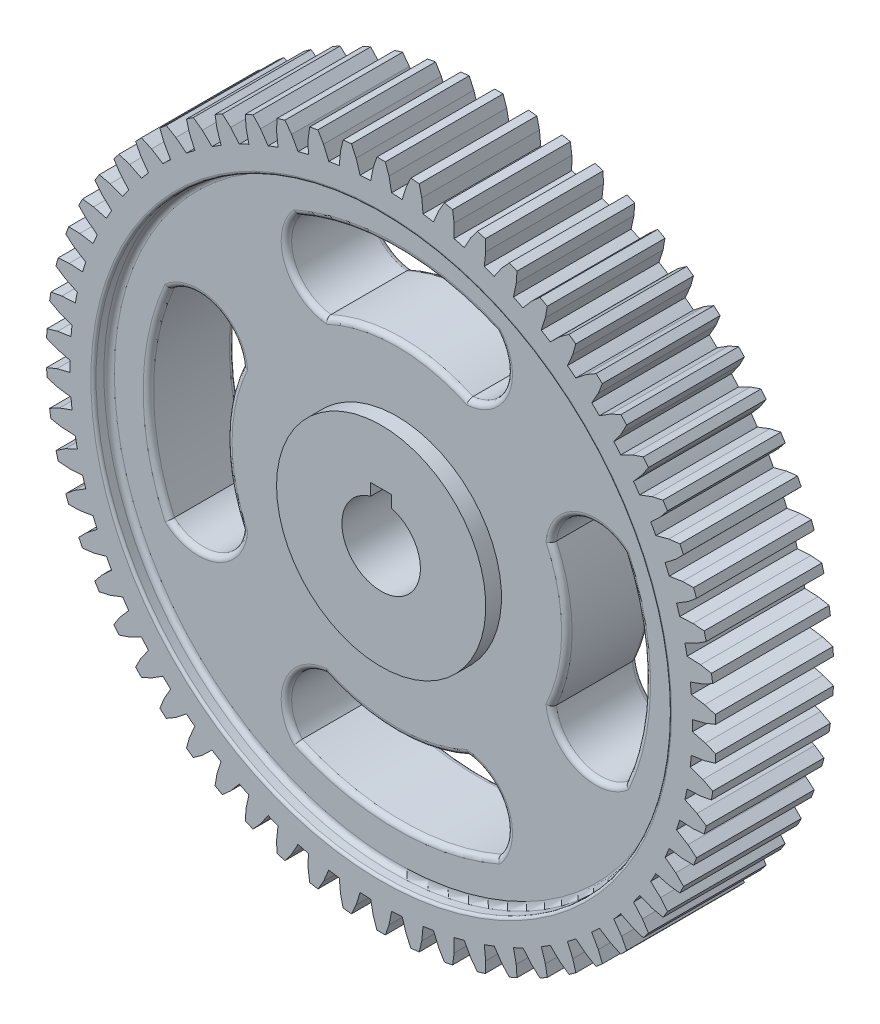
SolidWorks part; units mm, degrees
ref_plane "Front Plane" through (0, 0, 0) normal (0, 0, 1) x (1, 0, 0)
ref_plane "Top Plane" through (0, 0, 0) normal (0, 1, 0) x (1, 0, 0)
ref_plane "Right Plane" through (0, 0, 0) normal (1, 0, 0) x (0, 0, -1)
sketch "Sketch1" plane through (0, 0, 0) normal (0, 0, 1) x (1, 0, 0)
  line L0 (0, 151.13) -> (0, 197.7201) construction
  line L1 (-5.08, 151.0446) -> (-3.81, 157.4339)
  line L2 (-3.81, 157.4339) -> (-2.032, 162.5473)
  line L3 (5.08, 151.0446) -> (3.81, 157.4339)
  line L4 (3.81, 157.4339) -> (2.032, 162.5473)
  line L5 (-2.032, 162.5473) -> (2.032, 162.5473)
  line L6 (14.4231, 161.9189) -> (18.4662, 161.5077)
  line L7 (12.1369, 157.0116) -> (14.4231, 161.9189)
  line L8 (19.7178, 156.2407) -> (18.4662, 161.5077)
  line L9 (10.227, 150.7836) -> (12.1369, 157.0116)
  line L10 (20.3349, 149.7557) -> (19.7178, 156.2407)
  line L11 (30.7301, 159.629) -> (34.7109, 158.8109)
  line L12 (27.9592, 154.9782) -> (30.7301, 159.629)
  line L13 (35.4232, 153.4443) -> (34.7109, 158.8109)
  line L14 (25.429, 148.9753) -> (27.9592, 154.9782)
  line L15 (35.3811, 146.9301) -> (35.4232, 153.4443)
  line L16 (46.7219, 155.7011) -> (50.5995, 154.4845)
  line L17 (43.4946, 151.3544) -> (46.7219, 155.7011)
  line L18 (50.7652, 149.0733) -> (50.5995, 154.4845)
  line L19 (40.3702, 145.6383) -> (43.4946, 151.3544)
  line L20 (50.0642, 142.5968) -> (50.7652, 149.0733)
  line L21 (62.2342, 150.1754) -> (65.9688, 148.5728)
  line L22 (58.5838, 146.1776) -> (62.2342, 150.1754)
  line L23 (65.5862, 143.1726) -> (65.9688, 148.5728)
  line L24 (54.897, 140.8069) -> (58.5838, 146.1776)
  line L25 (64.2336, 136.8003) -> (65.5862, 143.1726)
  line L26 (77.1079, 143.1088) -> (80.6612, 141.1365)
  line L27 (73.0717, 139.5008) -> (77.1079, 143.1088)
  line L28 (79.7342, 135.8028) -> (80.6612, 141.1365)
  line L29 (68.8606, 134.5307) -> (73.0717, 139.5008)
  line L30 (77.7439, 129.6) -> (79.7342, 135.8028)
  line L31 (91.1903, 134.5737) -> (94.5259, 132.2521)
  line L32 (86.8099, 131.3925) -> (91.1903, 134.5737)
  line L33 (93.0641, 127.0395) -> (94.5259, 132.2521)
  line L34 (82.1175, 126.8739) -> (86.8099, 131.3925)
  line L35 (90.4565, 121.0698) -> (93.0641, 127.0395)
  line L36 (104.337, 124.6577) -> (107.4206, 122.0105)
  line L37 (99.6572, 121.936) -> (104.337, 124.6577)
  line L38 (105.439, 116.9725) -> (107.4206, 122.0105)
  line L39 (94.5318, 117.9153) -> (99.6572, 121.936)
  line L40 (102.2408, 111.2973) -> (105.439, 116.9725)
  line L41 (116.4131, 113.4625) -> (119.2131, 110.5169)
  line L42 (111.482, 111.2282) -> (116.4131, 113.4625)
  line L43 (116.7319, 105.7053) -> (119.2131, 110.5169)
  line L44 (105.9761, 107.7467) -> (111.482, 111.2282)
  line L45 (112.976, 100.3828) -> (116.7319, 105.7053)
  line L46 (127.2947, 101.103) -> (129.7823, 97.8893)
  line L47 (122.1628, 99.3791) -> (127.2947, 101.103)
  line L48 (126.827, 93.3534) -> (129.7823, 97.8893)
  line L49 (116.3329, 96.4724) -> (122.1628, 99.3791)
  line L50 (122.5519, 88.4382) -> (126.827, 93.3534)
  line L51 (136.87, 87.7061) -> (139.0197, 84.2572)
  line L52 (131.59, 86.5102) -> (136.87, 87.7061)
  line L53 (135.6207, 80.0435) -> (139.0197, 84.2572)
  line L54 (125.496, 84.2083) -> (131.59, 86.5102)
  line L55 (130.8703, 75.586) -> (135.6207, 80.0435)
  line L56 (145.0408, 73.4092) -> (146.8306, 69.7605)
  line L57 (139.667, 72.7536) -> (145.0408, 73.4092)
  line L58 (143.0228, 65.9123) -> (146.8306, 69.7605)
  line L59 (133.3713, 71.08) -> (139.667, 72.7536)
  line L60 (137.8457, 61.9583) -> (143.0228, 65.9123)
  line L61 (151.7234, 58.359) -> (153.1348, 54.548)
  line L62 (146.3107, 58.2505) -> (151.7234, 58.359)
  line L63 (148.9572, 51.1048) -> (153.1348, 54.548)
  line L64 (139.8781, 57.2224) -> (146.3107, 58.2505)
  line L65 (143.4067, 47.6948) -> (148.9572, 51.1048)
  line L66 (156.849, 42.71) -> (157.8676, 38.7758)
  line L67 (151.4532, 43.1496) -> (156.849, 42.71)
  line L68 (153.3631, 35.7728) -> (157.8676, 38.7758)
  line L69 (144.9495, 42.7775) -> (151.4532, 43.1496)
  line L70 (147.4961, 32.9419) -> (153.3631, 35.7728)
  line L71 (160.3652, 26.6227) -> (160.9806, 22.6056)
  line L72 (155.0415, 27.6059) -> (160.3652, 26.6227)
  line L73 (156.1954, 20.0738) -> (160.9806, 22.6056)
  line L74 (148.5335, 27.8938) -> (155.0415, 27.6059)
  line L75 (150.0721, 17.8509) -> (156.1954, 20.0738)
  line L76 (162.2358, 10.2623) -> (162.4416, 6.2035)
  line L77 (157.0389, 11.779) -> (162.2358, 10.2623)
  line L78 (157.4248, 4.1688) -> (162.4416, 6.2035)
  line L79 (150.5934, 12.7238) -> (157.0389, 11.779)
  line L80 (151.108, 2.5768) -> (157.4248, 4.1688)
  line L81 (162.4416, -6.2035) -> (162.2358, -10.2623)
  line L82 (157.4248, -4.1688) -> (162.4416, -6.2035)
  line L83 (157.0389, -11.779) -> (162.2358, -10.2623)
  line L84 (151.108, -2.5768) -> (157.4248, -4.1688)
  line L85 (150.5934, -12.7238) -> (157.0389, -11.779)
  line L86 (160.9806, -22.6056) -> (160.3652, -26.6227)
  line L87 (156.1954, -20.0738) -> (160.9806, -22.6056)
  line L88 (155.0415, -27.6059) -> (160.3652, -26.6227)
  line L89 (150.0721, -17.8509) -> (156.1954, -20.0738)
  line L90 (148.5335, -27.8938) -> (155.0415, -27.6059)
  line L91 (157.8676, -38.7758) -> (156.849, -42.71)
  line L92 (153.3631, -35.7728) -> (157.8676, -38.7758)
  line L93 (151.4532, -43.1496) -> (156.849, -42.71)
  line L94 (147.4961, -32.9419) -> (153.3631, -35.7728)
  line L95 (144.9495, -42.7775) -> (151.4532, -43.1496)
  line L96 (153.1348, -54.548) -> (151.7234, -58.359)
  line L97 (148.9572, -51.1048) -> (153.1348, -54.548)
  line L98 (146.3107, -58.2505) -> (151.7234, -58.359)
  line L99 (143.4067, -47.6948) -> (148.9572, -51.1048)
  line L100 (139.8781, -57.2224) -> (146.3107, -58.2505)
  line L101 (146.8306, -69.7605) -> (145.0408, -73.4092)
  line L102 (143.0228, -65.9123) -> (146.8306, -69.7605)
  line L103 (139.667, -72.7536) -> (145.0408, -73.4092)
  line L104 (137.8457, -61.9583) -> (143.0228, -65.9123)
  line L105 (133.3713, -71.08) -> (139.667, -72.7536)
  line L106 (139.0197, -84.2572) -> (136.87, -87.7061)
  line L107 (135.6207, -80.0435) -> (139.0197, -84.2572)
  line L108 (131.59, -86.5102) -> (136.87, -87.7061)
  line L109 (130.8703, -75.586) -> (135.6207, -80.0435)
  line L110 (125.496, -84.2083) -> (131.59, -86.5102)
  line L111 (129.7823, -97.8893) -> (127.2947, -101.103)
  line L112 (126.827, -93.3534) -> (129.7823, -97.8893)
  line L113 (122.1628, -99.3791) -> (127.2947, -101.103)
  line L114 (122.5519, -88.4382) -> (126.827, -93.3534)
  line L115 (116.3329, -96.4724) -> (122.1628, -99.3791)
  line L116 (119.2131, -110.5169) -> (116.4131, -113.4625)
  line L117 (116.7319, -105.7053) -> (119.2131, -110.5169)
  line L118 (111.482, -111.2282) -> (116.4131, -113.4625)
  line L119 (112.976, -100.3828) -> (116.7319, -105.7053)
  line L120 (105.9761, -107.7467) -> (111.482, -111.2282)
  line L121 (107.4206, -122.0105) -> (104.337, -124.6577)
  line L122 (105.439, -116.9725) -> (107.4206, -122.0105)
  line L123 (99.6572, -121.936) -> (104.337, -124.6577)
  line L124 (102.2408, -111.2973) -> (105.439, -116.9725)
  line L125 (94.5318, -117.9153) -> (99.6572, -121.936)
  line L126 (94.5259, -132.2521) -> (91.1903, -134.5737)
  line L127 (93.0641, -127.0395) -> (94.5259, -132.2521)
  line L128 (86.8099, -131.3925) -> (91.1903, -134.5737)
  line L129 (90.4565, -121.0698) -> (93.0641, -127.0395)
  line L130 (82.1175, -126.8739) -> (86.8099, -131.3925)
  line L131 (80.6612, -141.1365) -> (77.1079, -143.1088)
  line L132 (79.7342, -135.8028) -> (80.6612, -141.1365)
  line L133 (73.0717, -139.5008) -> (77.1079, -143.1088)
  line L134 (77.7439, -129.6) -> (79.7342, -135.8028)
  line L135 (68.8606, -134.5307) -> (73.0717, -139.5008)
  line L136 (65.9688, -148.5728) -> (62.2342, -150.1754)
  line L137 (65.5862, -143.1726) -> (65.9688, -148.5728)
  line L138 (58.5838, -146.1776) -> (62.2342, -150.1754)
  line L139 (64.2336, -136.8003) -> (65.5862, -143.1726)
  line L140 (54.897, -140.8069) -> (58.5838, -146.1776)
  line L141 (50.5995, -154.4845) -> (46.7219, -155.7011)
  line L142 (50.7652, -149.0733) -> (50.5995, -154.4845)
  line L143 (43.4946, -151.3544) -> (46.7219, -155.7011)
  line L144 (50.0642, -142.5968) -> (50.7652, -149.0733)
  line L145 (40.3702, -145.6383) -> (43.4946, -151.3544)
  line L146 (34.7109, -158.8109) -> (30.7301, -159.629)
  line L147 (35.4232, -153.4443) -> (34.7109, -158.8109)
  line L148 (27.9592, -154.9782) -> (30.7301, -159.629)
  line L149 (35.3811, -146.9301) -> (35.4232, -153.4443)
  line L150 (25.429, -148.9753) -> (27.9592, -154.9782)
  line L151 (18.4662, -161.5077) -> (14.4231, -161.9189)
  line L152 (19.7178, -156.2407) -> (18.4662, -161.5077)
  line L153 (12.1369, -157.0116) -> (14.4231, -161.9189)
  line L154 (20.3349, -149.7557) -> (19.7178, -156.2407)
  line L155 (10.227, -150.7836) -> (12.1369, -157.0116)
  line L156 (2.032, -162.5473) -> (-2.032, -162.5473)
  line L157 (3.81, -157.4339) -> (2.032, -162.5473)
  line L158 (-3.81, -157.4339) -> (-2.032, -162.5473)
  line L159 (5.08, -151.0446) -> (3.81, -157.4339)
  line L160 (-5.08, -151.0446) -> (-3.81, -157.4339)
  line L161 (-14.4231, -161.9189) -> (-18.4662, -161.5077)
  line L162 (-12.1369, -157.0116) -> (-14.4231, -161.9189)
  line L163 (-19.7178, -156.2407) -> (-18.4662, -161.5077)
  line L164 (-10.227, -150.7836) -> (-12.1369, -157.0116)
  line L165 (-20.3349, -149.7557) -> (-19.7178, -156.2407)
  line L166 (-30.7301, -159.629) -> (-34.7109, -158.8109)
  line L167 (-27.9592, -154.9782) -> (-30.7301, -159.629)
  line L168 (-35.4232, -153.4443) -> (-34.7109, -158.8109)
  line L169 (-25.429, -148.9753) -> (-27.9592, -154.9782)
  line L170 (-35.3811, -146.9301) -> (-35.4232, -153.4443)
  line L171 (-46.7219, -155.7011) -> (-50.5995, -154.4845)
  line L172 (-43.4946, -151.3544) -> (-46.7219, -155.7011)
  line L173 (-50.7652, -149.0733) -> (-50.5995, -154.4845)
  line L174 (-40.3702, -145.6383) -> (-43.4946, -151.3544)
  line L175 (-50.0642, -142.5968) -> (-50.7652, -149.0733)
  line L176 (-62.2342, -150.1754) -> (-65.9688, -148.5728)
  line L177 (-58.5838, -146.1776) -> (-62.2342, -150.1754)
  line L178 (-65.5862, -143.1726) -> (-65.9688, -148.5728)
  line L179 (-54.897, -140.8069) -> (-58.5838, -146.1776)
  line L180 (-64.2336, -136.8003) -> (-65.5862, -143.1726)
  line L181 (-77.1079, -143.1088) -> (-80.6612, -141.1365)
  line L182 (-73.0717, -139.5008) -> (-77.1079, -143.1088)
  line L183 (-79.7342, -135.8028) -> (-80.6612, -141.1365)
  line L184 (-68.8606, -134.5307) -> (-73.0717, -139.5008)
  line L185 (-77.7439, -129.6) -> (-79.7342, -135.8028)
  line L186 (-91.1903, -134.5737) -> (-94.5259, -132.2521)
  line L187 (-86.8099, -131.3925) -> (-91.1903, -134.5737)
  line L188 (-93.0641, -127.0395) -> (-94.5259, -132.2521)
  line L189 (-82.1175, -126.8739) -> (-86.8099, -131.3925)
  line L190 (-90.4565, -121.0698) -> (-93.0641, -127.0395)
  line L191 (-104.337, -124.6577) -> (-107.4206, -122.0105)
  line L192 (-99.6572, -121.936) -> (-104.337, -124.6577)
  line L193 (-105.439, -116.9725) -> (-107.4206, -122.0105)
  line L194 (-94.5318, -117.9153) -> (-99.6572, -121.936)
  line L195 (-102.2408, -111.2973) -> (-105.439, -116.9725)
  line L196 (-116.4131, -113.4625) -> (-119.2131, -110.5169)
  line L197 (-111.482, -111.2282) -> (-116.4131, -113.4625)
  line L198 (-116.7319, -105.7053) -> (-119.2131, -110.5169)
  line L199 (-105.9761, -107.7467) -> (-111.482, -111.2282)
  line L200 (-112.976, -100.3828) -> (-116.7319, -105.7053)
  line L201 (-127.2947, -101.103) -> (-129.7823, -97.8893)
  line L202 (-122.1628, -99.3791) -> (-127.2947, -101.103)
  line L203 (-126.827, -93.3534) -> (-129.7823, -97.8893)
  line L204 (-116.3329, -96.4724) -> (-122.1628, -99.3791)
  line L205 (-122.5519, -88.4382) -> (-126.827, -93.3534)
  line L206 (-136.87, -87.7061) -> (-139.0197, -84.2572)
  line L207 (-131.59, -86.5102) -> (-136.87, -87.7061)
  line L208 (-135.6207, -80.0435) -> (-139.0197, -84.2572)
  line L209 (-125.496, -84.2083) -> (-131.59, -86.5102)
  line L210 (-130.8703, -75.586) -> (-135.6207, -80.0435)
  line L211 (-145.0408, -73.4092) -> (-146.8306, -69.7605)
  line L212 (-139.667, -72.7536) -> (-145.0408, -73.4092)
  line L213 (-143.0228, -65.9123) -> (-146.8306, -69.7605)
  line L214 (-133.3713, -71.08) -> (-139.667, -72.7536)
  line L215 (-137.8457, -61.9583) -> (-143.0228, -65.9123)
  line L216 (-151.7234, -58.359) -> (-153.1348, -54.548)
  line L217 (-146.3107, -58.2505) -> (-151.7234, -58.359)
  line L218 (-148.9572, -51.1048) -> (-153.1348, -54.548)
  line L219 (-139.8781, -57.2224) -> (-146.3107, -58.2505)
  line L220 (-143.4067, -47.6948) -> (-148.9572, -51.1048)
  line L221 (-156.849, -42.71) -> (-157.8676, -38.7758)
  line L222 (-151.4532, -43.1496) -> (-156.849, -42.71)
  line L223 (-153.3631, -35.7728) -> (-157.8676, -38.7758)
  line L224 (-144.9495, -42.7775) -> (-151.4532, -43.1496)
  line L225 (-147.4961, -32.9419) -> (-153.3631, -35.7728)
  line L226 (-160.3652, -26.6227) -> (-160.9806, -22.6056)
  line L227 (-155.0415, -27.6059) -> (-160.3652, -26.6227)
  line L228 (-156.1954, -20.0738) -> (-160.9806, -22.6056)
  line L229 (-148.5335, -27.8938) -> (-155.0415, -27.6059)
  line L230 (-150.0721, -17.8509) -> (-156.1954, -20.0738)
  line L231 (-162.2358, -10.2623) -> (-162.4416, -6.2035)
  line L232 (-157.0389, -11.779) -> (-162.2358, -10.2623)
  line L233 (-157.4248, -4.1688) -> (-162.4416, -6.2035)
  line L234 (-150.5934, -12.7238) -> (-157.0389, -11.779)
  line L235 (-151.108, -2.5768) -> (-157.4248, -4.1688)
  line L236 (-162.4416, 6.2035) -> (-162.2358, 10.2623)
  line L237 (-157.4248, 4.1688) -> (-162.4416, 6.2035)
  line L238 (-157.0389, 11.779) -> (-162.2358, 10.2623)
  line L239 (-151.108, 2.5768) -> (-157.4248, 4.1688)
  line L240 (-150.5934, 12.7238) -> (-157.0389, 11.779)
  line L241 (-160.9806, 22.6056) -> (-160.3652, 26.6227)
  line L242 (-156.1954, 20.0738) -> (-160.9806, 22.6056)
  line L243 (-155.0415, 27.6059) -> (-160.3652, 26.6227)
  line L244 (-150.0721, 17.8509) -> (-156.1954, 20.0738)
  line L245 (-148.5335, 27.8938) -> (-155.0415, 27.6059)
  line L246 (-157.8676, 38.7758) -> (-156.849, 42.71)
  line L247 (-153.3631, 35.7728) -> (-157.8676, 38.7758)
  line L248 (-151.4532, 43.1496) -> (-156.849, 42.71)
  line L249 (-147.4961, 32.9419) -> (-153.3631, 35.7728)
  line L250 (-144.9495, 42.7775) -> (-151.4532, 43.1496)
  line L251 (-153.1348, 54.548) -> (-151.7234, 58.359)
  line L252 (-148.9572, 51.1048) -> (-153.1348, 54.548)
  line L253 (-146.3107, 58.2505) -> (-151.7234, 58.359)
  line L254 (-143.4067, 47.6948) -> (-148.9572, 51.1048)
  line L255 (-139.8781, 57.2224) -> (-146.3107, 58.2505)
  line L256 (-146.8306, 69.7605) -> (-145.0408, 73.4092)
  line L257 (-143.0228, 65.9123) -> (-146.8306, 69.7605)
  line L258 (-139.667, 72.7536) -> (-145.0408, 73.4092)
  line L259 (-137.8457, 61.9583) -> (-143.0228, 65.9123)
  line L260 (-133.3713, 71.08) -> (-139.667, 72.7536)
  line L261 (-139.0197, 84.2572) -> (-136.87, 87.7061)
  line L262 (-135.6207, 80.0435) -> (-139.0197, 84.2572)
  line L263 (-131.59, 86.5102) -> (-136.87, 87.7061)
  line L264 (-130.8703, 75.586) -> (-135.6207, 80.0435)
  line L265 (-125.496, 84.2083) -> (-131.59, 86.5102)
  line L266 (-129.7823, 97.8893) -> (-127.2947, 101.103)
  line L267 (-126.827, 93.3534) -> (-129.7823, 97.8893)
  line L268 (-122.1628, 99.3791) -> (-127.2947, 101.103)
  line L269 (-122.5519, 88.4382) -> (-126.827, 93.3534)
  line L270 (-116.3329, 96.4724) -> (-122.1628, 99.3791)
  line L271 (-119.2131, 110.5169) -> (-116.4131, 113.4625)
  line L272 (-116.7319, 105.7053) -> (-119.2131, 110.5169)
  line L273 (-111.482, 111.2282) -> (-116.4131, 113.4625)
  line L274 (-112.976, 100.3828) -> (-116.7319, 105.7053)
  line L275 (-105.9761, 107.7467) -> (-111.482, 111.2282)
  line L276 (-107.4206, 122.0105) -> (-104.337, 124.6577)
  line L277 (-105.439, 116.9725) -> (-107.4206, 122.0105)
  line L278 (-99.6572, 121.936) -> (-104.337, 124.6577)
  line L279 (-102.2408, 111.2973) -> (-105.439, 116.9725)
  line L280 (-94.5318, 117.9153) -> (-99.6572, 121.936)
  line L281 (-94.5259, 132.2521) -> (-91.1903, 134.5737)
  line L282 (-93.0641, 127.0395) -> (-94.5259, 132.2521)
  line L283 (-86.8099, 131.3925) -> (-91.1903, 134.5737)
  line L284 (-90.4565, 121.0698) -> (-93.0641, 127.0395)
  line L285 (-82.1175, 126.8739) -> (-86.8099, 131.3925)
  line L286 (-80.6612, 141.1365) -> (-77.1079, 143.1088)
  line L287 (-79.7342, 135.8028) -> (-80.6612, 141.1365)
  line L288 (-73.0717, 139.5008) -> (-77.1079, 143.1088)
  line L289 (-77.7439, 129.6) -> (-79.7342, 135.8028)
  line L290 (-68.8606, 134.5307) -> (-73.0717, 139.5008)
  line L291 (-65.9688, 148.5728) -> (-62.2342, 150.1754)
  line L292 (-65.5862, 143.1726) -> (-65.9688, 148.5728)
  line L293 (-58.5838, 146.1776) -> (-62.2342, 150.1754)
  line L294 (-64.2336, 136.8003) -> (-65.5862, 143.1726)
  line L295 (-54.897, 140.8069) -> (-58.5838, 146.1776)
  line L296 (-50.5995, 154.4845) -> (-46.7219, 155.7011)
  line L297 (-50.7652, 149.0733) -> (-50.5995, 154.4845)
  line L298 (-43.4946, 151.3544) -> (-46.7219, 155.7011)
  line L299 (-50.0642, 142.5968) -> (-50.7652, 149.0733)
  line L300 (-40.3702, 145.6383) -> (-43.4946, 151.3544)
  line L301 (-34.7109, 158.8109) -> (-30.7301, 159.629)
  line L302 (-35.4232, 153.4443) -> (-34.7109, 158.8109)
  line L303 (-27.9592, 154.9782) -> (-30.7301, 159.629)
  line L304 (-35.3811, 146.9301) -> (-35.4232, 153.4443)
  line L305 (-25.429, 148.9753) -> (-27.9592, 154.9782)
  line L306 (-18.4662, 161.5077) -> (-14.4231, 161.9189)
  line L307 (-19.7178, 156.2407) -> (-18.4662, 161.5077)
  line L308 (-12.1369, 157.0116) -> (-14.4231, 161.9189)
  line L309 (-20.3349, 149.7557) -> (-19.7178, 156.2407)
  line L310 (-10.227, 150.7836) -> (-12.1369, 157.0116)
  circle A0 centre (0, 0) radius 157.48 construction
  circle A1 centre (0, 0) radius 162.56 construction
  arc A3 (-20.3349, 149.7557) -> (-25.429, 148.9753) centre (0, 0) ccw
  arc A4 (-35.3811, 146.9301) -> (-40.3702, 145.6383) centre (0, 0) ccw
  arc A5 (-50.0642, 142.5968) -> (-54.897, 140.8069) centre (0, 0) ccw
  arc A6 (-64.2336, 136.8003) -> (-68.8606, 134.5307) centre (0, 0) ccw
  arc A7 (-77.7439, 129.6) -> (-82.1175, 126.8739) centre (0, 0) ccw
  arc A8 (-90.4565, 121.0698) -> (-94.5318, 117.9153) centre (0, 0) ccw
  arc A9 (-102.2408, 111.2973) -> (-105.9761, 107.7467) centre (0, 0) ccw
  arc A10 (-122.5519, 88.4382) -> (-125.496, 84.2083) centre (0, 0) ccw
  arc A11 (-130.8703, 75.586) -> (-133.3713, 71.08) centre (0, 0) ccw
  arc A12 (-137.8457, 61.9583) -> (-139.8781, 57.2224) centre (0, 0) ccw
  arc A13 (-143.4067, 47.6948) -> (-144.9495, 42.7775) centre (0, 0) ccw
  arc A14 (-147.4961, 32.9419) -> (-148.5335, 27.8938) centre (0, 0) ccw
  arc A15 (-150.0721, 17.8509) -> (-150.5934, 12.7238) centre (0, 0) ccw
  arc A16 (-151.108, 2.5768) -> (-151.108, -2.5768) centre (0, 0) ccw
  arc A17 (-150.5934, -12.7238) -> (-150.0721, -17.8509) centre (0, 0) ccw
  arc A18 (-148.5335, -27.8938) -> (-147.4961, -32.9419) centre (0, 0) ccw
  arc A19 (-144.9495, -42.7775) -> (-143.4067, -47.6948) centre (0, 0) ccw
  arc A20 (-139.8781, -57.2224) -> (-137.8457, -61.9583) centre (0, 0) ccw
  arc A21 (-133.3713, -71.08) -> (-130.8703, -75.586) centre (0, 0) ccw
  arc A22 (-125.496, -84.2083) -> (-122.5519, -88.4382) centre (0, 0) ccw
  arc A23 (-116.3329, -96.4724) -> (-112.976, -100.3828) centre (0, 0) ccw
  arc A24 (-105.9761, -107.7467) -> (-102.2408, -111.2973) centre (0, 0) ccw
  arc A25 (-94.5318, -117.9153) -> (-90.4565, -121.0698) centre (0, 0) ccw
  arc A26 (-82.1175, -126.8739) -> (-77.7439, -129.6) centre (0, 0) ccw
  arc A27 (-68.8606, -134.5307) -> (-64.2336, -136.8003) centre (0, 0) ccw
  arc A28 (-54.897, -140.8069) -> (-50.0642, -142.5968) centre (0, 0) ccw
  arc A29 (-40.3702, -145.6383) -> (-35.3811, -146.9301) centre (0, 0) ccw
  arc A30 (-25.429, -148.9753) -> (-20.3349, -149.7557) centre (0, 0) ccw
  arc A31 (-10.227, -150.7836) -> (-5.08, -151.0446) centre (0, 0) ccw
  arc A32 (5.08, -151.0446) -> (10.227, -150.7836) centre (0, 0) ccw
  arc A33 (20.3349, -149.7557) -> (25.429, -148.9753) centre (0, 0) ccw
  arc A34 (35.3811, -146.9301) -> (40.3702, -145.6383) centre (0, 0) ccw
  arc A35 (50.0642, -142.5968) -> (54.897, -140.8069) centre (0, 0) ccw
  arc A36 (64.2336, -136.8003) -> (68.8606, -134.5307) centre (0, 0) ccw
  arc A37 (77.7439, -129.6) -> (82.1175, -126.8739) centre (0, 0) ccw
  arc A38 (90.4565, -121.0698) -> (94.5318, -117.9153) centre (0, 0) ccw
  arc A39 (102.2408, -111.2973) -> (105.9761, -107.7467) centre (0, 0) ccw
  arc A40 (112.976, -100.3828) -> (116.3329, -96.4724) centre (0, 0) ccw
  arc A41 (122.5519, -88.4382) -> (125.496, -84.2083) centre (0, 0) ccw
  arc A42 (130.8703, -75.586) -> (133.3713, -71.08) centre (0, 0) ccw
  arc A43 (137.8457, -61.9583) -> (139.8781, -57.2224) centre (0, 0) ccw
  arc A44 (143.4067, -47.6948) -> (144.9495, -42.7775) centre (0, 0) ccw
  arc A45 (147.4961, -32.9419) -> (148.5335, -27.8938) centre (0, 0) ccw
  arc A46 (150.0721, -17.8509) -> (150.5934, -12.7238) centre (0, 0) ccw
  arc A47 (151.108, -2.5768) -> (151.108, 2.5768) centre (0, 0) ccw
  arc A48 (150.5934, 12.7238) -> (150.0721, 17.8509) centre (0, 0) ccw
  arc A49 (148.5335, 27.8938) -> (147.4961, 32.9419) centre (0, 0) ccw
  arc A50 (144.9495, 42.7775) -> (143.4067, 47.6948) centre (0, 0) ccw
  arc A51 (139.8781, 57.2224) -> (137.8457, 61.9583) centre (0, 0) ccw
  arc A52 (133.3713, 71.08) -> (130.8703, 75.586) centre (0, 0) ccw
  arc A53 (125.496, 84.2083) -> (122.5519, 88.4382) centre (0, 0) ccw
  arc A54 (116.3329, 96.4724) -> (112.976, 100.3828) centre (0, 0) ccw
  arc A55 (105.9761, 107.7467) -> (102.2408, 111.2973) centre (0, 0) ccw
  arc A56 (94.5318, 117.9153) -> (90.4565, 121.0698) centre (0, 0) ccw
  arc A57 (82.1175, 126.8739) -> (77.7439, 129.6) centre (0, 0) ccw
  arc A58 (68.8606, 134.5307) -> (64.2336, 136.8003) centre (0, 0) ccw
  arc A59 (54.897, 140.8069) -> (50.0642, 142.5968) centre (0, 0) ccw
  arc A60 (40.3702, 145.6383) -> (35.3811, 146.9301) centre (0, 0) ccw
  arc A61 (25.429, 148.9753) -> (20.3349, 149.7557) centre (0, 0) ccw
  arc A62 (10.227, 150.7836) -> (5.08, 151.0446) centre (0, 0) ccw
  arc A63 (-5.08, 151.0446) -> (-10.227, 150.7836) centre (0, 0) ccw
  arc A64 (-112.976, 100.3828) -> (-116.3329, 96.4724) centre (0, 0) ccw
  point P387 (0, 0)
  dimension "D1" = 314.96
  dimension "D2" = 325.12
  dimension "D3" = 151.13
  dimension "D4" = 7.62
  dimension "D5" = 10.16
  dimension "D6" = 4.064
  dimension "D7" = 62
extrude "Boss-Extrude1" add sketch "Sketch1" along normal blind 57.15
sketch "Sketch2" plane through (0, 0, 57.15) normal (0, 0, 1) x (1, 0, 0)
  circle A0 centre (0, 0) radius 139.7
  dimension "D1" = 279.4
extrude "Cut-Extrude1" cut sketch "Sketch2" against normal blind 7.62
sketch "Sketch3" plane through (0, 0, 49.53) normal (0, 0, 1) x (1, 0, 0)
  circle A0 centre (0, 0) radius 50.8
  dimension "D1" = 101.6
extrude "Boss-Extrude2" add sketch "Sketch3" along normal blind 7.62
sketch "Sketch4" plane through (0, 0, 57.15) normal (0, 0, 1) x (1, 0, 0)
  line L0 (0, 0) -> (0, 61.8794) construction
  line L3 (-5.08, 18.3602) -> (-5.08, 24.13)
  line L4 (-5.08, 24.13) -> (5.08, 24.13)
  line L5 (5.08, 18.3602) -> (5.08, 24.13)
  line L6 (-5.08, 13.97) -> (5.08, 24.13) construction
  line L7 (-5.08, 24.13) -> (5.08, 13.97) construction
  arc A0 (-5.08, 18.3602) -> (5.08, 18.3602) centre (0, 0) ccw
  point P3 (0, 19.05)
  dimension "D1" = 38.1
  dimension "D2" = 10.16
  dimension "D3" = 10.16
extrude "Cut-Extrude2" cut sketch "Sketch4" against normal blind 158.496
sketch "Sketch5" plane through (0, 0, 49.53) normal (0, 0, 1) x (1, 0, 0)
  line L0 (0, 0) -> (0, 206.9383) construction
  arc A0 (48.4176, 110.5086) -> (-48.4176, 110.5086) centre (0, 0) ccw
  arc A1 (34.4763, 75.0059) -> (-34.4763, 75.0059) centre (0, 0) ccw
  arc A2 (-34.4763, 75.0059) -> (-48.4176, 110.5086) centre (-32.0266, 96.4565) cw
  arc A3 (34.4763, 75.0059) -> (48.4176, 110.5086) centre (32.0266, 96.4565) ccw
  arc A4 (110.5086, -48.4176) -> (110.5086, 48.4176) centre (0, 0) ccw
  arc A5 (75.0059, 34.4763) -> (110.5086, 48.4176) centre (96.4565, 32.0266) cw
  arc A6 (75.0059, -34.4763) -> (75.0059, 34.4763) centre (0, 0) ccw
  arc A7 (75.0059, -34.4763) -> (110.5086, -48.4176) centre (96.4565, -32.0266) ccw
  arc A8 (-48.4176, -110.5086) -> (48.4176, -110.5086) centre (0, 0) ccw
  arc A9 (34.4763, -75.0059) -> (48.4176, -110.5086) centre (32.0266, -96.4565) cw
  arc A10 (-34.4763, -75.0059) -> (34.4763, -75.0059) centre (0, 0) ccw
  arc A11 (-34.4763, -75.0059) -> (-48.4176, -110.5086) centre (-32.0266, -96.4565) ccw
  arc A12 (-110.5086, 48.4176) -> (-110.5086, -48.4176) centre (0, 0) ccw
  arc A13 (-75.0059, -34.4763) -> (-110.5086, -48.4176) centre (-96.4565, -32.0266) cw
  arc A14 (-75.0059, 34.4763) -> (-75.0059, -34.4763) centre (0, 0) ccw
  arc A15 (-75.0059, 34.4763) -> (-110.5086, 48.4176) centre (-96.4565, 32.0266) ccw
  point P30 (0, 0)
  dimension "D1" = 241.3
  dimension "D2" = 165.1
  dimension "D3" = 21.59
  dimension "D4" = 4
extrude "Cut-Extrude3" cut sketch "Sketch5" against normal blind 107.9715
ref_plane "Plane1" through (0, 0, 28.575) normal (0, 0, 1) x (1, 0, 0)
mirror "Mirror1" about plane through (0, 0, 28.575) normal (0, 0, 1) of "Cut-Extrude1", "Boss-Extrude2", "Cut-Extrude2"
fillet "Fillet1" radius 2.54 17 edges at (0, -120.65, 49.53) (52.1227, -88.5651, 49.53) (0, -82.55, 49.53) (-52.1227, -88.5651, 49.53) (88.5651, -52.1227, 49.53) (120.65, 0, 49.53) (88.5651, 52.1227, 49.53) (82.55, 0, 49.53) (-88.5651, -52.1227, 49.53) (-82.55, 0, 49.53) (-88.5651, 52.1227, 49.53) (-120.65, 0, 49.53) (52.1227, 88.5651, 49.53) (0, 120.65, 49.53) (0, 82.55, 49.53) (-52.1227, 88.5651, 49.53) (139.7, 0, 49.53)
fillet "Fillet2" radius 1.27 1 edges at (139.7, 0, 57.15)
fillet "Fillet3" radius 2.54 17 edges at (139.7, 0, 7.62) (0, -120.65, 7.62) (-52.1227, -88.5651, 7.62) (0, -82.55, 7.62) (52.1227, -88.5651, 7.62) (88.5651, -52.1227, 7.62) (120.65, 0, 7.62) (82.55, 0, 7.62) (88.5651, 52.1227, 7.62) (0, 82.55, 7.62) (52.1227, 88.5651, 7.62) (0, 120.65, 7.62) (-52.1227, 88.5651, 7.62) (-88.5651, -52.1227, 7.62) (-82.55, 0, 7.62) (-88.5651, 52.1227, 7.62) (-120.65, 0, 7.62)
fillet "Fillet4" radius 1.27 1 edges at (139.7, 0, 0)
